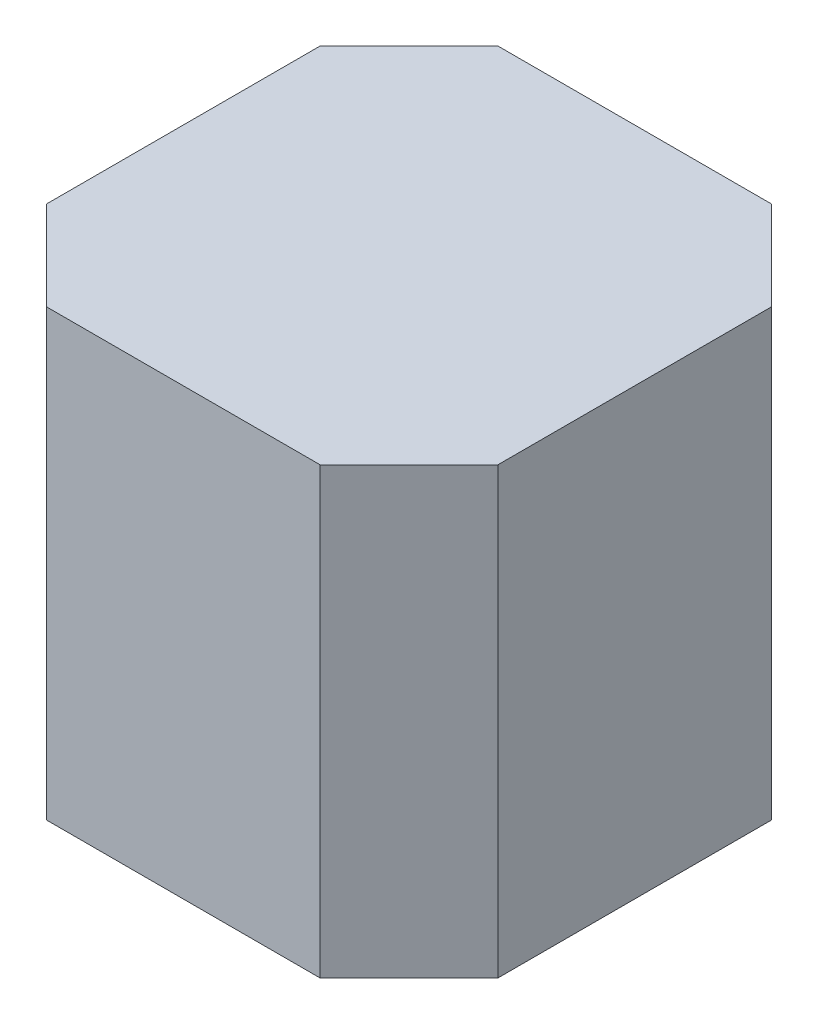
SolidWorks part; units mm, degrees
ref_plane "Спереди" through (0, 0, 0) normal (0, 0, 1) x (1, 0, 0)
ref_plane "Сверху" through (0, 0, 0) normal (0, 1, 0) x (1, 0, 0)
ref_plane "Справа" through (0, 0, 0) normal (1, 0, 0) x (0, 0, -1)
other "Configuration Table"
sketch "Эскиз1" plane through (0, 0, 0) normal (0, 1, 0) x (1, 0, 0)
  line L1 (-1.27, 1.27) -> (1.27, 1.27)
  line L2 (-1.27, 1.27) -> (-1.27, -1.27)
  line L3 (-1.27, -1.27) -> (1.27, -1.27)
  line L4 (1.27, 1.27) -> (1.27, -1.27)
  line L5 (0, -1.27) -> (0, 1.27) construction
  line L6 (-1.27, 0) -> (1.27, 0) construction
  point P0 (0, 0)
  dimension "D1" = 2.54
extrude "Бобышка-Вытянуть1" add sketch "Эскиз1" along normal blind 2.5
chamfer "Фаска1" distance 0.5 angle 45 4 edges at (-1.27, 1.25, -1.27) (-1.27, 1.25, 1.27) (1.27, 1.25, 1.27) (1.27, 1.25, -1.27)
